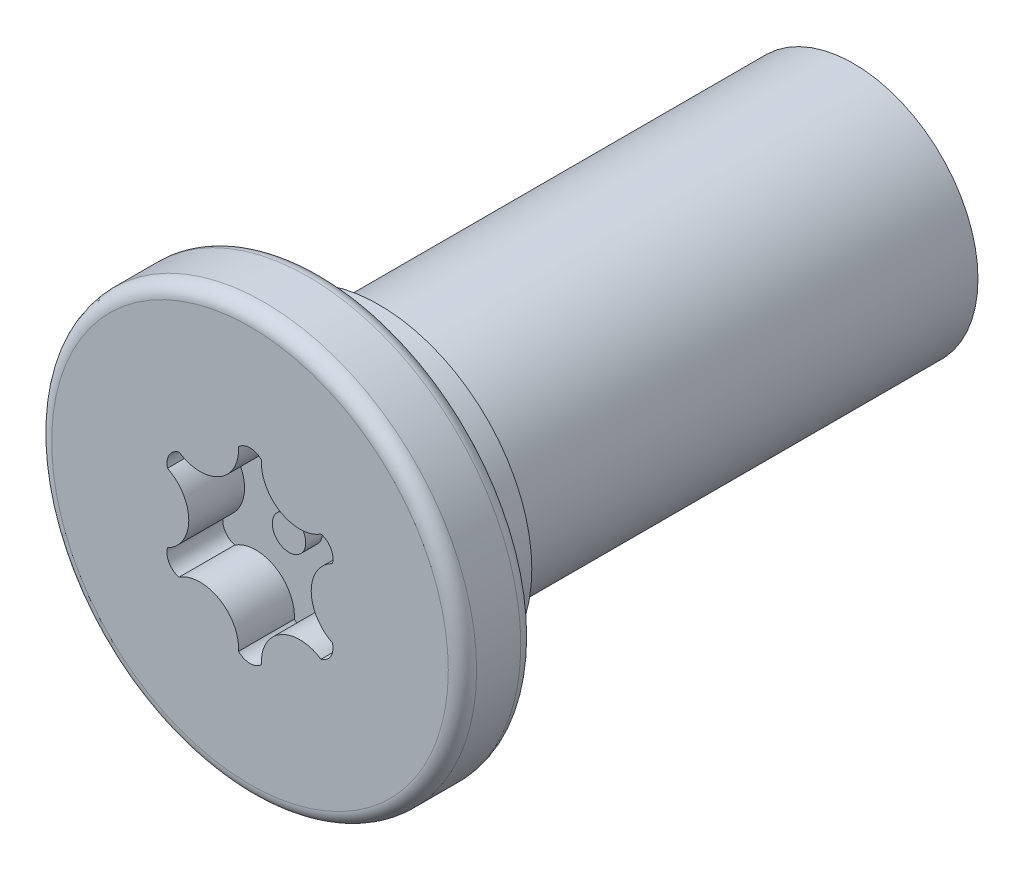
SolidWorks part; units mm, degrees
ref_plane "Front Plane" through (0, 0, 0) normal (0, 0, 1) x (1, 0, 0)
ref_plane "Top Plane" through (0, 0, 0) normal (0, 1, 0) x (1, 0, 0)
ref_plane "Right Plane" through (0, 0, 0) normal (1, 0, 0) x (0, 0, -1)
sketch "Sketch2" plane through (0, 0, 0) normal (1, 0, 0) x (0, 0, -1)
  line L1 (0, 0) -> (1.3, 0)
  line L2 (0, 0) -> (0, 3.81)
  line L3 (0, 3.81) -> (1.3, 3.81)
  line L4 (1.3, 0) -> (1.3, 3.81)
  line L5 (1.3, 0) -> (14, 0)
  line L6 (1.3, 0) -> (1.3, 2.23)
  line L7 (1.3, 2.23) -> (14, 2.23)
  line L8 (14, 0) -> (14, 2.23)
  dimension "D1" = 3.81
  dimension "D2" = 1.3
  dimension "D3" = 12.7
  dimension "D4" = 2.23
revolve "Revolve1" add sketch "Sketch2" angle 360 about L5
sketch "Sketch3" plane through (0, 0, 0) normal (0, 0, 1) x (1, 0, 0)
  line L0 (0, 1.3843) -> (0, 0)
  line L3 (1.1845, -1.0048) -> (2.4257, -1.0048)
  line L4 (0, 1.675) -> (0, 1.6727)
  line L5 (0, 1.675) -> (0, 1.6727)
  line L6 (0, 1.6727) -> (0, 1.675)
  line L8 (1.0407, 1.8026) -> (1.1012, 1.9073)
  line L9 (1.3857, 1.205) -> (2.5818, 1.205)
  line L10 (0, 0) -> (0.8375, 1.4506)
  line L11 (0, 0) -> (2.5818, 0)
  line L14 (2.5818, 0) -> (2.5818, 1.205)
  line L15 (1.3857, 1.205) -> (-0.1691, 1.205)
  circle A0 centre (0, 0) radius 1.675
  arc A7 (1.1845, -1.0048) -> (1.0345, -1.0748) centre (0.8546, -0.4934) cw
  arc A16 (-0.2051, 1.5894) -> (0.2051, 1.5894) centre (0, 1.3843) cw
  arc A18 (0.2051, 1.5894) -> (1.2739, 0.9723) centre (0.8938, 1.5482) ccw
  arc A19 (1.479, 0.6171) -> (1.479, -0.6171) centre (1.7877, 0) ccw
  arc A20 (1.2739, 0.9723) -> (1.479, 0.6171) centre (1.1988, 0.6922) cw
  arc A21 (1.2739, -0.9723) -> (0.2051, -1.5894) centre (0.8938, -1.5482) ccw
  arc A22 (1.479, -0.6171) -> (1.2739, -0.9723) centre (1.1988, -0.6922) cw
  arc A23 (-0.2051, -1.5894) -> (-1.2739, -0.9723) centre (-0.8938, -1.5482) ccw
  arc A24 (0.2051, -1.5894) -> (-0.2051, -1.5894) centre (0, -1.3843) cw
  arc A25 (-1.479, -0.6171) -> (-1.479, 0.6171) centre (-1.7877, 0) ccw
  arc A26 (-1.2739, -0.9723) -> (-1.479, -0.6171) centre (-1.1988, -0.6922) cw
  arc A27 (-1.2739, 0.9723) -> (-0.2051, 1.5894) centre (-0.8938, 1.5482) ccw
  arc A28 (-1.479, 0.6171) -> (-1.2739, 0.9723) centre (-1.1988, 0.6922) cw
  point P38 (0, 0)
  point P52 (0, 0)
  dimension "D1" = 3.35
  dimension "D4" = 1.205
  dimension "D2" = 6
  dimension "D5" = 60
extrude "Cut-Extrude3" cut sketch "Sketch3" against normal blind 1
fillet "Fillet12" radius 0.254 2 edges at (3.81, 0, 0) (3.81, 0, -1.3)
sketch "Sketch7" plane through (0, 0, -14) normal (0, 0, -1) x (-1, 0, 0)
  circle A0 centre (0, 0) radius 2.23
  dimension "D1" = 4.46
extrude "Cut-Extrude6" cut sketch "Sketch7" against normal blind 12.7
sketch "Sketch11" plane through (0, 0, -1.3) normal (0, 0, -1) x (-1, 0, 0)
  circle A0 centre (0, 0) radius 2.23
  circle A1 centre (0, 0) radius 2.738
extrude "Boss-Extrude1" add sketch "Sketch11" along normal blind 1.016
sketch "Sketch12" plane through (0, 0, -1.3) normal (0, 0, -1) x (-1, 0, 0)
  circle A0 centre (0, 0) radius 2.23
extrude "Boss-Extrude2" add sketch "Sketch12" along normal blind 12.7
sketch "Sketch14" plane through (0, 0, -1) normal (0, 0, 1) x (1, 0, 0)
  circle A0 centre (0, 0) radius 0.3
extrude "Boss-Extrude4" add sketch "Sketch14" along normal blind 0.3
sketch "Sketch15" plane through (0, 0, -14) normal (0, 0, -1) x (-1, 0, 0)
  circle A0 centre (0, 0) radius 2.23
extrude "Cut-Extrude7" cut sketch "Sketch15" against normal blind 12.7
sketch "Sketch16" plane through (0, 0, -1.3) normal (0, 0, -1) x (-1, 0, 0)
  circle A0 centre (0, 0) radius 2.23
extrude "Boss-Extrude5" add sketch "Sketch16" along normal blind 9.525
